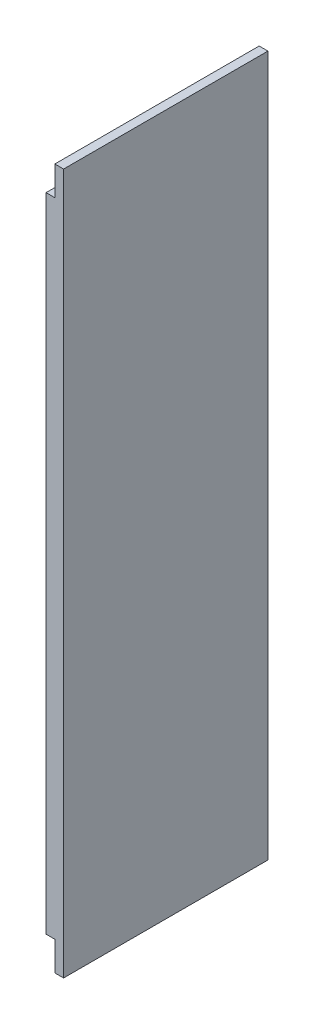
SolidWorks part; units mm, degrees
ref_plane "前视基准面" through (0, 0, 0) normal (0, 0, 1) x (1, 0, 0)
ref_plane "上视基准面" through (0, 0, 0) normal (0, 1, 0) x (1, 0, 0)
ref_plane "右视基准面" through (0, 0, 0) normal (1, 0, 0) x (0, 0, -1)
sketch "草图2" plane through (0, 0, 0) normal (0, 0, 1) x (1, 0, 0)
  line L2 (-97, 0) -> (-94, 0)
  line L3 (-97, 0) -> (-97, -240)
  line L4 (-97, -240) -> (-94, -240)
  line L5 (-94, 0) -> (-94, -240)
extrude "凸台-拉伸1" add sketch "草图2" against normal up to surface (70 mm away)
sketch "草图3" plane through (0, 0, 0) normal (0, 0, 1) x (1, 0, 0)
  line L0 (-97, 0) -> (-97, -240) construction
  line L1 (-100, -10) -> (-97, -10)
  line L2 (-100, -10) -> (-100, -230.0019)
  line L3 (-100, -230.0019) -> (-97, -230.0019)
  line L4 (-97, -10) -> (-97, -230.0019)
extrude "凸台-拉伸2" add sketch "草图3" against normal up to surface (70 mm away)
